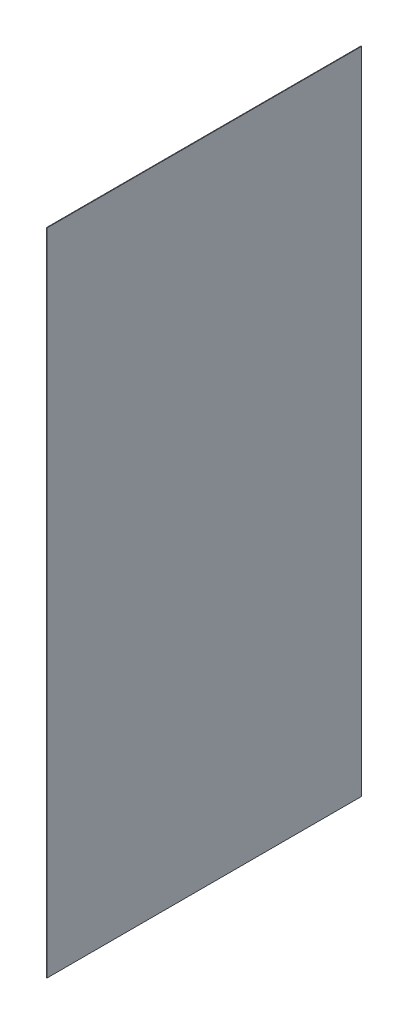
SolidWorks part; units mm, degrees
ref_plane "Front Plane" through (0, 0, 0) normal (0, 0, 1) x (1, 0, 0)
ref_plane "Top Plane" through (0, 0, 0) normal (0, 1, 0) x (1, 0, 0)
ref_plane "Right Plane" through (0, 0, 0) normal (1, 0, 0) x (0, 0, -1)
ref_plane "Plane1" through (3.175, 0, 0) normal (1, 0, 0) x (0, 0, -1)
sketch "Sketch1" plane through (3.175, 0, 0) normal (1, 0, 0) x (0, 0, -1)
  line L0 (-32.8621, 3504.1394) -> (-32.8621, -51.8606)
  line L1 (-32.8621, -51.8606) -> (1687.9879, -51.8606)
  line L2 (1687.9879, -51.8606) -> (1687.9879, 3504.1394)
  line L3 (1687.9879, 3504.1394) -> (-32.8621, 3504.1394)
extrude "Boss-Extrude1" add sketch "Sketch1" against normal blind 3.175
